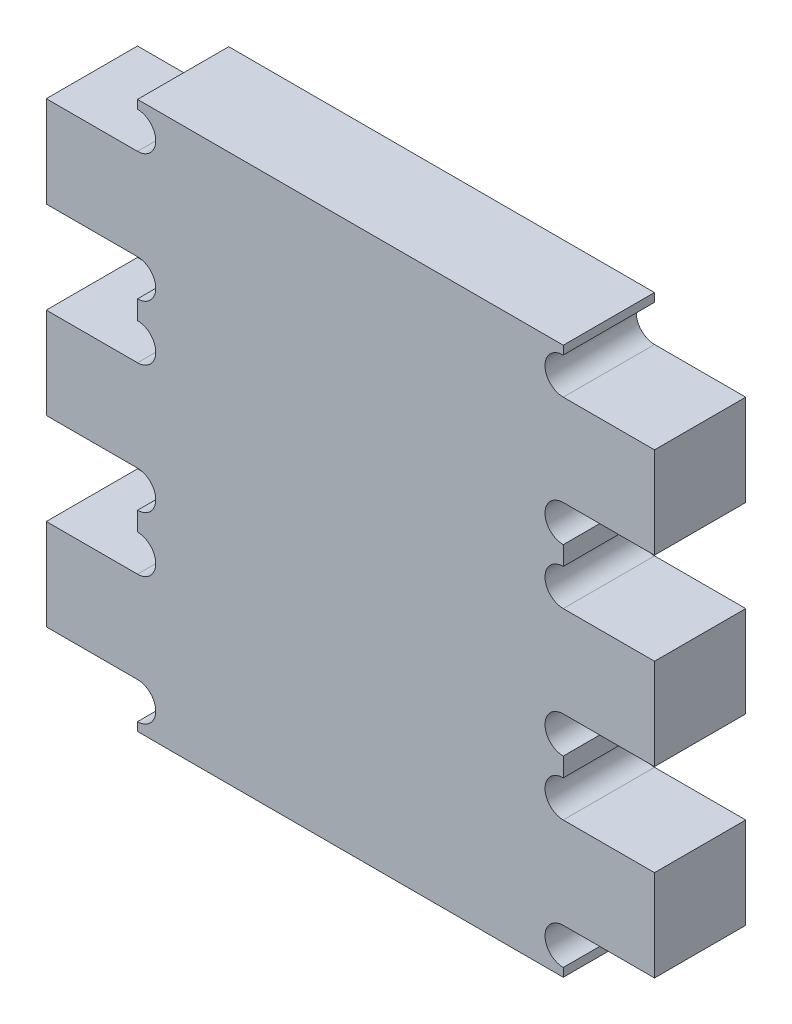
SolidWorks part; units mm, degrees
ref_plane "Ebene vorne" through (0, 0, 0) normal (0, 0, 1) x (1, 0, 0)
ref_plane "Ebene oben" through (0, 0, 0) normal (0, 1, 0) x (1, 0, 0)
ref_plane "Ebene rechts" through (0, 0, 0) normal (1, 0, 0) x (0, 0, -1)
sketch "Skizze1" plane through (0, 0, 0) normal (0, 0, 1) x (1, 0, 0)
  line L0 (15, 90) -> (15, 88.6)
  line L1 (15, 90) -> (85, 90)
  line L2 (15, 82.6) -> (0, 82.6)
  line L5 (0, 82.6) -> (0, 67.6)
  line L6 (0, 67.6) -> (15, 67.6)
  line L7 (15, 61.6) -> (15, 58.5)
  line L8 (15, 52.5) -> (0, 52.5)
  line L9 (0, 52.5) -> (0, 37.5)
  line L10 (0, 37.5) -> (15, 37.5)
  line L11 (15, 31.5) -> (15, 28.4)
  line L13 (0, 22.4) -> (0, 7.4)
  line L14 (15, 22.4) -> (0, 22.4)
  line L15 (0, 7.4) -> (15, 7.4)
  line L16 (85, 88.6) -> (85, 90)
  line L17 (85, 82.6) -> (100, 82.6)
  line L18 (100, 67.6) -> (85, 67.6)
  line L19 (85, 61.6) -> (85, 58.5)
  line L20 (85, 52.5) -> (100, 52.5)
  line L21 (100, 52.5) -> (100, 37.5)
  line L22 (100, 37.5) -> (85, 37.5)
  line L23 (85, 31.5) -> (85, 28.4)
  line L24 (100, 82.6) -> (100, 67.6)
  line L25 (85, 22.4) -> (100, 22.4)
  line L26 (100, 7.4) -> (85, 7.4)
  line L27 (100, 22.4) -> (100, 7.4)
  line L29 (15, 1.4) -> (15, 0)
  line L30 (85, 1.4) -> (85, 0)
  line L31 (85, 0) -> (15, 0)
  arc A0 (15, 88.6) -> (15, 82.6) centre (15, 85.6) cw
  arc A1 (15, 67.6) -> (15, 61.6) centre (15, 64.6) cw
  arc A2 (15, 58.5) -> (15, 52.5) centre (15, 55.5) cw
  arc A3 (15, 37.5) -> (15, 31.5) centre (15, 34.5) cw
  arc A4 (15, 28.4) -> (15, 22.4) centre (15, 25.4) cw
  arc A5 (15, 7.4) -> (15, 1.4) centre (15, 4.4) cw
  arc A6 (85, 1.4) -> (85, 7.4) centre (85, 4.4) cw
  arc A7 (85, 22.4) -> (85, 28.4) centre (85, 25.4) cw
  arc A8 (85, 31.5) -> (85, 37.5) centre (85, 34.5) cw
  arc A9 (85, 52.5) -> (85, 58.5) centre (85, 55.5) cw
  arc A10 (85, 61.6) -> (85, 67.6) centre (85, 64.6) cw
  arc A11 (85, 82.6) -> (85, 88.6) centre (85, 85.6) cw
  dimension "D13" = 15
  dimension "D14" = 100
  dimension "D15" = 3.1
  dimension "D16" = 3.1
  dimension "D17" = 3.1
  dimension "D18" = 3.1
  dimension "D12" = 7.4
  dimension "D19" = 6
  dimension "D20" = 90
  dimension "D21" = 6
  dimension "D22" = 6
  dimension "D23" = 6
  dimension "D2" = 15
  dimension "D3" = 15
  dimension "D4" = 15
  dimension "D5" = 15
  dimension "D6" = 15
  dimension "D7" = 15.1
  dimension "D8" = 15.1
  dimension "D9" = 15
  dimension "D10" = 15
  dimension "D11" = 15
  dimension "D24" = 6
  dimension "D25" = 6
  dimension "D26" = 6
  dimension "D27" = 6
extrude "outline" add sketch "Skizze1" along normal blind 15
